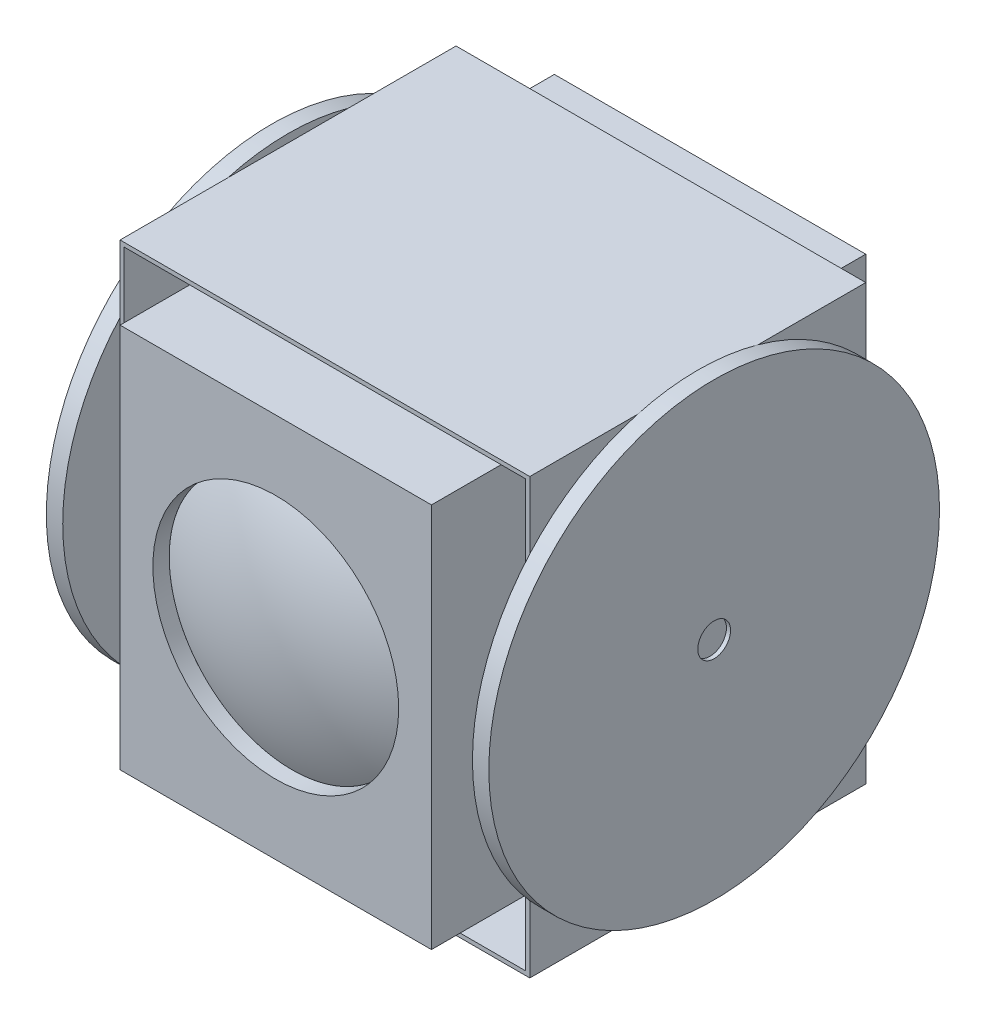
SolidWorks part; units mm, degrees
ref_plane "Front Plane" through (0, 0, 0) normal (0, 0, 1) x (1, 0, 0)
ref_plane "Top Plane" through (0, 0, 0) normal (0, 1, 0) x (1, 0, 0)
ref_plane "Right Plane" through (0, 0, 0) normal (1, 0, 0) x (0, 0, -1)
sketch "Sketch1" plane through (0, 0, 0) normal (1, 0, 0) x (0, 0, -1)
  circle A0 centre (0, 0) radius 34.925
  dimension "D1" = 69.85
extrude "Boss-Extrude1" add sketch "Sketch1" along normal blind 2.54
ref_plane "Plane1" through (0, 33.02, 0) normal (0, 1, 0) x (1, 0, 0)
sketch "Sketch2" plane through (0, 33.02, 0) normal (0, 1, 0) x (1, 0, 0)
  line L0 (0, 26.035) -> (-63.5, 26.035)
  line L1 (0, 34.925) -> (0, -34.925) construction
  line L2 (-63.5, 26.035) -> (-63.5, -26.035)
  line L3 (-63.5, -26.035) -> (0, -26.035)
  line L4 (0, -26.035) -> (0, 26.035)
  dimension "D1" = 63.5
  dimension "D2" = 8.89
  dimension "D3" = 8.89
extrude "Boss-Extrude2" add sketch "Sketch2" along normal blind 0.635
mirror "Mirror1" about plane through (0, 0, 0) normal (0, 1, 0) of "Boss-Extrude2"
sketch "Sketch3" plane through (0, 0, 26.035) normal (0, 0, 1) x (1, 0, 0)
  line L0 (-31.75, 33.655) -> (-31.75, -33.02) construction
  line L1 (-63.5, 33.655) -> (0, 33.655) construction
  line L2 (-63.5, -33.02) -> (0, -33.02) construction
ref_plane "Plane2" through (-31.75, 0, 0) normal (-1, 0, 0) x (0, 0, 1)
mirror "Mirror2" about plane through (-31.75, 0, 0) normal (-1, 0, 0) of "Boss-Extrude1"
sketch "Sketch4" plane through (0, 0, 26.035) normal (0, 0, 1) x (1, 0, 0)
  line L0 (0, 33.02) -> (0, -33.02) construction
  line L1 (-55.88, 29.845) -> (-7.62, 29.845)
  line L2 (-55.88, 29.845) -> (-55.88, -29.845)
  line L3 (-55.88, -29.845) -> (-7.62, -29.845)
  line L4 (-7.62, 29.845) -> (-7.62, -29.845)
  line L5 (-63.5, -33.02) -> (-63.5, 33.02) construction
  line L7 (-63.5, 33.02) -> (0, 33.02) construction
  line L8 (-63.5, -33.02) -> (0, -33.02) construction
  dimension "D1" = 7.62
  dimension "D2" = 7.62
  dimension "D3" = 3.175
  dimension "D4" = 3.175
extrude "Boss-Extrude3" add sketch "Sketch4" along normal blind 7.62 and the other way offset from surface (59.69 mm away) 7.62 separate body
sketch "Sketch5" plane through (0, 0, 33.655) normal (0, 0, 1) x (1, 0, 0)
  line L0 (-31.75, 0) -> (-31.75, -29.845) construction
  line L1 (-55.88, -29.845) -> (-7.62, -29.845) construction
  line L2 (-55.88, 0) -> (-31.75, 0) construction
  line L3 (-55.88, 29.845) -> (-55.88, -29.845) construction
  circle A0 centre (-31.75, 0) radius 19.05
  dimension "D1" = 38.1
extrude "Cut-Extrude1" cut sketch "Sketch5" against normal blind 2.54 contours A0
sketch "Sketch6" plane through (0, 0, 0) normal (0, 1, 0) x (1, 0, 0)
  line L0 (-7.62, 0) -> (-55.88, 0) construction
  line L2 (-7.62, 33.655) -> (-7.62, -33.655) construction
  line L3 (-55.88, 33.655) -> (-55.88, -33.655) construction
  line L4 (-31.75, 0) -> (-31.75, -31.115) construction
  line L5 (-50.8, -31.115) -> (-12.7, -31.115) construction
  line L6 (-31.75, -31.115) -> (-31.75, -35.5427)
  line L7 (-31.75, -31.115) -> (-12.7035, -31.115)
  arc A0 (-31.75, -35.5427) -> (-12.7035, -31.115) centre (-31.75, 7.6373) ccw
  dimension "D1" = 86.36
  dimension "D2" = 43.18
  dimension "D3" = 12.7035
revolve "Revolve1" add sketch "Sketch6" angle 360 about L6
sketch "Sketch7" plane through (0, 0, 0) normal (-1, 0, 0) x (0, 0, 1)
  line L0 (26.035, 33.02) -> (26.035, -33.02)
  line L1 (-26.035, -33.02) -> (-26.035, 33.02)
  line L2 (-26.035, 33.02) -> (26.035, 33.02)
  line L3 (26.035, 33.02) -> (36.8145, 33.0575)
  line L4 (26.035, -33.02) -> (-26.035, -33.02)
extrude "Boss-Extrude4" add sketch "Sketch7" along normal blind 0.635 contours L0 L4 L1 L2
mirror "Mirror3" about plane through (-31.75, 0, 0) normal (-1, 0, 0) of "Boss-Extrude4"
sketch "Sketch8" plane through (2.54, 0, 0) normal (1, 0, 0) x (0, 0, -1)
  circle A0 centre (0, 0) radius 2.54
  dimension "D1" = 5.08
extrude "Cut-Extrude2" cut sketch "Sketch8" against normal blind 0.635
